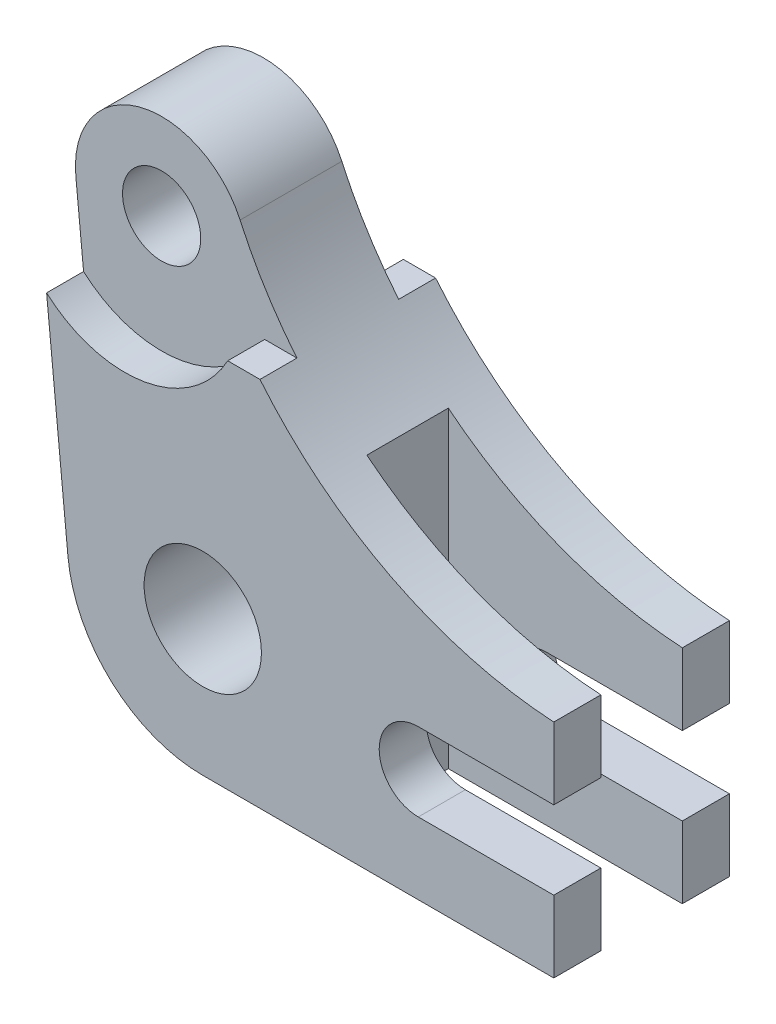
SolidWorks part; units mm, degrees
ref_plane "Front Plane" through (0, 0, 0) normal (0, 0, 1) x (1, 0, 0)
ref_plane "Top Plane" through (0, 0, 0) normal (0, 1, 0) x (1, 0, 0)
ref_plane "Right Plane" through (0, 0, 0) normal (1, 0, 0) x (0, 0, -1)
sketch "Sketch1" plane through (0, 0, 0) normal (0, 0, 1) x (1, 0, 0)
  line L0 (0, 0) -> (0, -6.35) construction
  line L1 (0, -6.35) -> (0, 0) construction
  line L2 (0, 0) -> (12.6821, -47.3304) construction
  line L3 (-9.2127, -49.4785) -> (-13.9331, -1.367)
  line L4 (12.6821, -69.3304) -> (69.6821, -69.3304)
  line L5 (69.6821, -69.3304) -> (69.6821, -51.3304) construction
  line L6 (69.6821, -51.3304) -> (47.6821, -51.3304) construction
  line L7 (47.6821, -57.6804) -> (69.6821, -57.6804)
  line L8 (69.6821, -57.6804) -> (69.6821, -69.3304)
  line L9 (47.6821, -44.9804) -> (69.6821, -44.9804)
  line L10 (69.6821, -44.9804) -> (69.6821, -33.3304)
  circle A0 centre (0, 0) radius 6.35
  arc A1 (12.7428, 5.7983) -> (-13.9331, -1.367) centre (0, 0) ccw
  circle A2 centre (12.6821, -47.3304) radius 9.525
  arc A3 (12.6821, -69.3304) -> (-9.2127, -49.4785) centre (12.6821, -47.3304) cw
  arc A4 (47.6821, -44.9804) -> (47.6821, -57.6804) centre (47.6821, -51.3304) ccw
  arc A5 (12.7428, 5.7983) -> (69.6821, -33.3304) centre (73.7263, 33.5475) ccw
  point P16 (66.2778, -26.7796)
  point P21 (16.5223, -3.9573)
  dimension "D1" = 12.7
  dimension "D2" = 14
  dimension "D5" = 19.05
  dimension "D8" = 22
  dimension "D9" = 6.35
  dimension "D12" = 67
  dimension "D3" = 15
  dimension "D4" = 49
  dimension "D6" = 18
  dimension "D7" = 57
  dimension "D10" = 22
  dimension "D11" = 36
extrude "Boss-Extrude1" add sketch "Sketch1" along normal mid plane 28.52
sketch "Sketch2" plane through (0, 0, 14.26) normal (0, 0, 1) x (1, 0, 0)
  line L0 (-13.9331, -1.367) -> (-9.2127, -49.4785) construction
  line L1 (-12.6788, -14.1509) -> (-13.9331, -1.367)
  line L2 (0, 0) -> (0, -9) construction
  line L3 (0, -9) -> (21.97, -9) construction
  line L4 (21.97, -9) -> (16.7332, -9)
  circle A0 centre (0, 0) radius 6.35 construction
  circle A1 centre (0, 0) radius 6.35
  arc A2 (-12.6788, -14.1509) -> (16.7332, -9) centre (0, 0) ccw
  arc A3 (12.7428, 5.7983) -> (-13.9331, -1.367) centre (0, 0) ccw construction
  arc A4 (12.7428, 5.7983) -> (-13.9331, -1.367) centre (0, 0) ccw
  arc A5 (12.7428, 5.7983) -> (69.6821, -33.3304) centre (73.7263, 33.5475) ccw construction
  arc A6 (12.7428, 5.7983) -> (21.97, -9) centre (73.7263, 33.5475) ccw
  point P10 (0, 0)
  dimension "D1" = 19
  dimension "D2" = 9
extrude "Cut-Extrude1" cut sketch "Sketch2" against normal blind 6
mirror "Mirror1" about plane through (0, 0, 0) normal (0, 0, 1) of "Cut-Extrude1"
sketch "Sketch3" plane through (0, 0, 0) normal (0, 0, 1) x (1, 0, 0)
  line L1 (31.6821, -41.9331) -> (31.6821, -18.6185) construction
  line L2 (31.6821, -18.6185) -> (31.6821, -69.3304)
  line L3 (12.6821, -69.3304) -> (69.6821, -69.3304) construction
  line L4 (31.6821, -69.3304) -> (69.6821, -69.3304)
  line L5 (69.6821, -57.6804) -> (47.6821, -57.6804) construction
  line L6 (47.6821, -44.9804) -> (69.6821, -44.9804) construction
  line L7 (69.6821, -44.9804) -> (69.6821, -33.3304) construction
  line L8 (69.6821, -69.3304) -> (69.6821, -57.6804) construction
  line L9 (69.6821, -57.6804) -> (47.6821, -57.6804)
  line L10 (47.6821, -44.9804) -> (69.6821, -44.9804)
  line L11 (69.6821, -44.9804) -> (69.6821, -33.3304)
  line L12 (69.6821, -69.3304) -> (69.6821, -57.6804)
  arc A0 (21.97, -9) -> (69.6821, -33.3304) centre (73.7263, 33.5475) ccw construction
  arc A1 (31.6821, -18.6185) -> (69.6821, -33.3304) centre (73.7263, 33.5475) ccw
  arc A2 (47.6821, -44.9804) -> (47.6821, -57.6804) centre (47.6821, -51.3304) ccw construction
  arc A3 (47.6821, -44.9804) -> (47.6821, -57.6804) centre (47.6821, -51.3304) ccw
  point P15 (32.6687, -41.9331)
  dimension "D1" = 38
extrude "Cut-Extrude2" cut sketch "Sketch3" against normal mid plane 13.23
